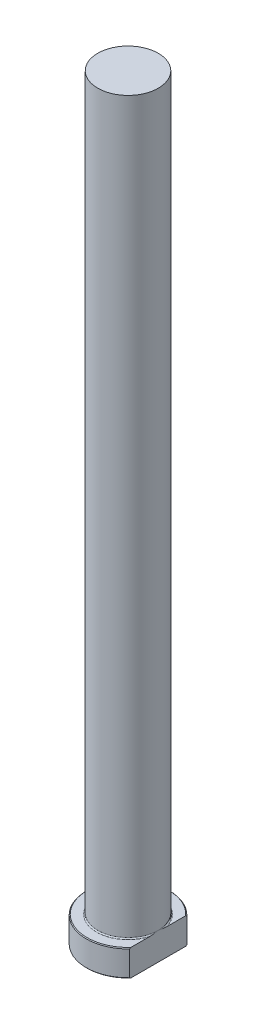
SolidWorks part; units mm, degrees
ref_plane "Front Plane" through (0, 0, 0) normal (0, 0, 1) x (1, 0, 0)
ref_plane "Top Plane" through (0, 0, 0) normal (0, 1, 0) x (1, 0, 0)
ref_plane "Right Plane" through (0, 0, 0) normal (1, 0, 0) x (0, 0, -1)
sketch "Sketch1" plane through (0, 0, 0) normal (0, 0, 1) x (1, 0, 0)
  line L0 (0, 259.9588) -> (0, -15.1925) construction
  line L1 (0, 0) -> (-11, 0)
  line L2 (-11, 0) -> (-11, 7)
  line L3 (-11, 7) -> (-8, 7)
  line L4 (-8, 7) -> (-8, 200)
  line L5 (-8, 200) -> (0, 200)
  line L6 (0, 200) -> (0, 0)
  dimension "L" = 200
  dimension "H" = 22
  dimension "T" = 7
  dimension "D" = 16
revolve "Revolve1" add sketch "Sketch1" angle 360 about L0
chamfer "Chamfer1" distance 0.2 angle 45 2 edges at (0, 7, 11) (0, 0, 11)
fillet "Fillet1" radius 0.3 1 edges at (0, 7, 8)
sketch "Sketch2" plane through (0, 0, 0) normal (0, 1, 0) x (1, 0, 0)
  line L0 (8, 7.5498) -> (8, -7.5498)
  circle A0 centre (0, 0) radius 11 construction
  arc A1 (8, -7.5498) -> (8, 7.5498) centre (0, 0) ccw
  circle A2 centre (0, 0) radius 8 construction
extrude "KEY" cut sketch "Sketch2" along normal through all
